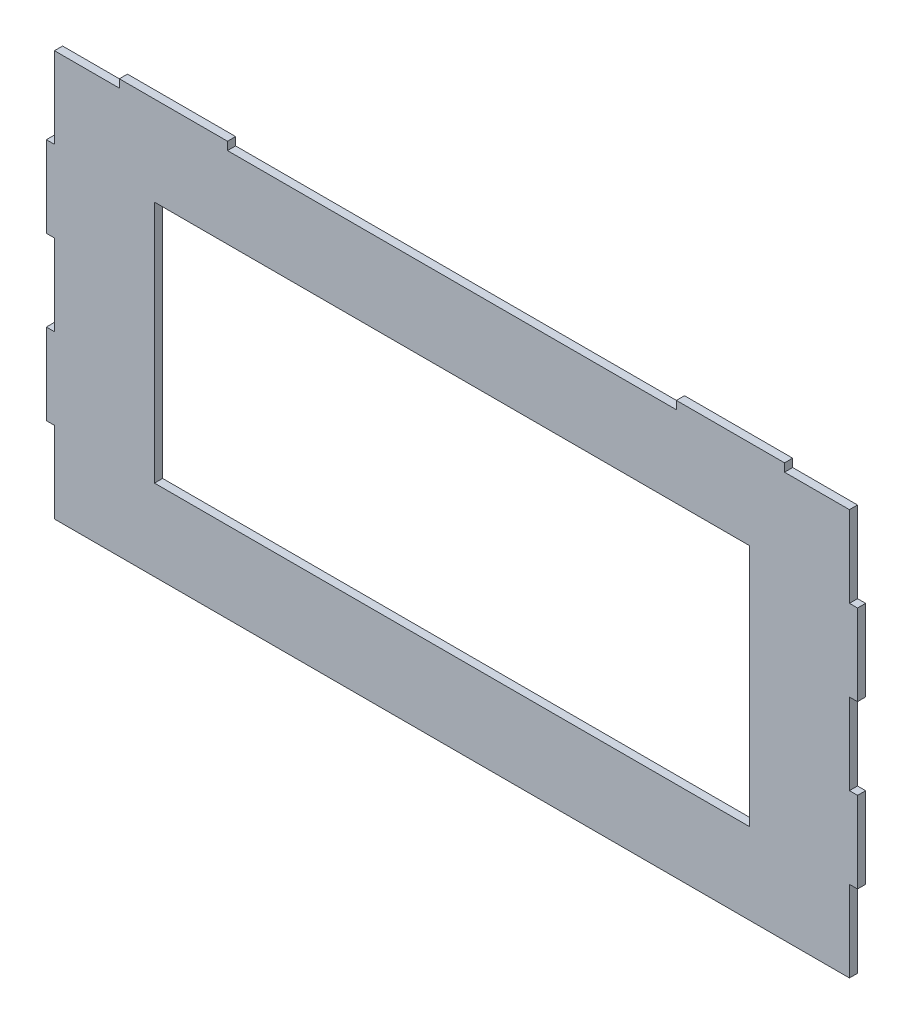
SolidWorks part; units mm, degrees
ref_plane "Alzado" through (0, 0, 0) normal (0, 0, 1) x (1, 0, 0)
ref_plane "Planta" through (0, 0, 0) normal (0, 1, 0) x (1, 0, 0)
ref_plane "Vista lateral" through (0, 0, 0) normal (1, 0, 0) x (0, 0, -1)
sketch "Croquis1" plane through (0, 0, 0) normal (0, 0, 1) x (1, 0, 0)
  line L1 (-147, -75) -> (147, -75)
  line L2 (-147, -75) -> (-147, 75)
  line L3 (-147, 75) -> (147, 75)
  line L4 (147, -75) -> (147, 75)
  line L5 (-147, -75) -> (147, 75) construction
  line L6 (-147, 75) -> (147, -75) construction
  line L7 (-110, -45) -> (110, -45)
  line L8 (-110, -45) -> (-110, 45)
  line L9 (-110, 45) -> (110, 45)
  line L10 (110, -45) -> (110, 45)
  line L11 (-110, -45) -> (110, 45) construction
  line L12 (-110, 45) -> (110, -45) construction
  point P0 (0, 0)
  point P6 (0, 0)
  dimension "D1" = 150
  dimension "D2" = 294
  dimension "D3" = 90
  dimension "D4" = 220
extrude "Saliente-Extruir1" add sketch "Croquis1" along normal blind 3
sketch "Croquis2" plane through (0, 75, 0) normal (0, 1, 0) x (1, 0, 0)
  line L0 (147, -3) -> (-147, -3) construction
  line L1 (-123, -3) -> (-83, -3)
  line L2 (-123, -3) -> (-123, 0)
  line L3 (-123, 0) -> (-83, 0)
  line L4 (-83, -3) -> (-83, 0)
  line L5 (147, 0) -> (-147, 0) construction
  line L6 (-147, -3) -> (-147, 0) construction
  line L7 (83, -3) -> (123, -3)
  line L8 (83, -3) -> (83, 0)
  line L9 (83, 0) -> (123, 0)
  line L10 (123, -3) -> (123, 0)
  line L11 (147, -3) -> (147, 0) construction
  dimension "D1" = 24
  dimension "D2" = 40
  dimension "D3" = 24
  dimension "D4" = 40
extrude "Saliente-Extruir2" add sketch "Croquis2" along normal blind 3
sketch "Croquis3" plane through (147, 0, 0) normal (1, 0, 0) x (0, 0, -1)
  line L0 (-3, -75) -> (-3, 75) construction
  line L1 (-3, 45) -> (0, 45)
  line L2 (-3, 45) -> (-3, 15)
  line L3 (-3, 15) -> (0, 15)
  line L4 (0, 45) -> (0, 15)
  line L5 (0, -75) -> (0, 75) construction
  line L6 (-3, -75) -> (0, -75) construction
  line L7 (-3, -15) -> (0, -15)
  line L8 (-3, -15) -> (-3, -45)
  line L9 (-3, -45) -> (0, -45)
  line L10 (0, -15) -> (0, -45)
  dimension "D1" = 30
  dimension "D2" = 30
  dimension "D3" = 30
  dimension "D4" = 30
extrude "Saliente-Extruir3" add sketch "Croquis3" along normal blind 3
sketch "Croquis4" plane through (-147, 0, 0) normal (-1, 0, 0) x (0, 0, 1)
  line L0 (0, 75) -> (0, -75) construction
  line L1 (0, 45) -> (3, 45)
  line L2 (0, 45) -> (0, 15)
  line L3 (0, 15) -> (3, 15)
  line L4 (3, 45) -> (3, 15)
  line L5 (3, 75) -> (3, -75) construction
  line L6 (3, -75) -> (0, -75) construction
  line L7 (0, -15) -> (3, -15)
  line L8 (0, -15) -> (0, -45)
  line L9 (0, -45) -> (3, -45)
  line L10 (3, -15) -> (3, -45)
  dimension "D1" = 30
  dimension "D2" = 30
  dimension "D3" = 30
  dimension "D4" = 30
extrude "Saliente-Extruir4" add sketch "Croquis4" along normal blind 3
